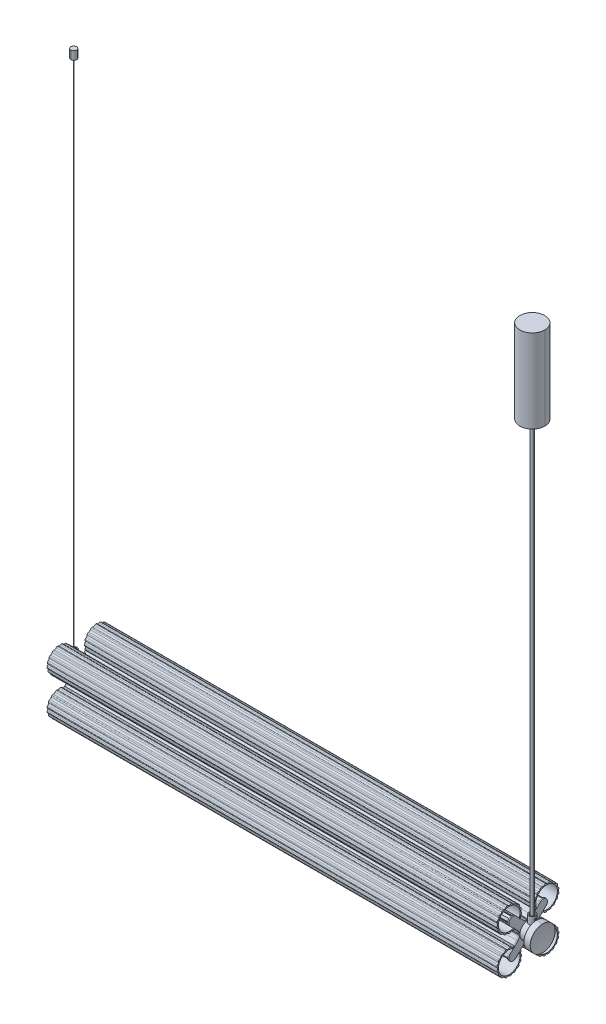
SolidWorks part; units mm, degrees
ref_plane "Alzado" through (0, 0, 0) normal (0, 0, 1) x (1, 0, 0)
ref_plane "Planta" through (0, 0, 0) normal (0, 1, 0) x (1, 0, 0)
ref_plane "Vista lateral" through (0, 0, 0) normal (1, 0, 0) x (0, 0, -1)
imported_body "CRYS_C1359.STEP<1>"
ref_plane "Plano1" through (120, 0, 0) normal (1, 0, 0) x (0, 0, -1)
sketch "Croquis3" plane through (120, 0, 0) normal (1, 0, 0) x (0, 0, -1)
  line L0 (6108.253, 137.8682) -> (6195.2271, 224.8423) construction
  circle A15 centre (6151.74, 181.3552) radius 30.0043 construction
  arc A16 (6107.8994, 151.7982) -> (6122.183, 137.5146) centre (6115.4039, 145.0192) ccw construction
  arc A17 (6195.5806, 210.9123) -> (6181.2971, 225.1959) centre (6188.0761, 217.6913) ccw construction
  circle A21 centre (6196.615, 226.2302) radius 30
  circle A22 centre (6196.615, 226.2302) radius 26
  circle A23 centre (6196.615, 136.4803) radius 30
  circle A24 centre (6196.615, 136.4803) radius 26
  circle A25 centre (6106.8651, 136.4803) radius 30
  circle A26 centre (6106.8651, 136.4803) radius 26
  circle A27 centre (6106.8651, 226.2302) radius 30
  circle A28 centre (6106.8651, 226.2302) radius 26
  point P18 (6184.6205, 235.4489)
  point P19 (6097.6464, 148.4748)
  point P20 (6205.8337, 214.2357)
  point P21 (6118.8596, 127.2616)
  point P29 (6151.74, 181.3552)
  dimension "D1" = 60
  dimension "D2" = 52
  dimension "D3" = 4
extrude "Saliente-Extruir1" add sketch "Croquis3" along normal blind 1080
ref_plane "Plano2" through (160, 0, 0) normal (1, 0, 0) x (0, 0, -1)
sketch "Croquis65" plane through (120, 0, 0) normal (-1, 0, 0) x (0, 0, 1)
  circle A1 centre (-6151.74, 181.3509) radius 30 construction
  circle A37 centre (-6106.8651, 226.2302) radius 32 construction
  circle A56 centre (-6106.8651, 258.2302) radius 4
  circle A75 centre (-6095.3053, 256.0693) radius 4
  circle A94 centre (-6085.3068, 249.8785) radius 4
  circle A95 centre (-6078.2198, 240.4938) radius 4
  circle A96 centre (-6075.0016, 229.1828) radius 4
  circle A97 centre (-6076.0866, 217.473) radius 4
  circle A98 centre (-6081.3285, 206.9459) radius 4
  circle A99 centre (-6090.0192, 199.0233) radius 4
  circle A100 centre (-6100.9851, 194.7751) radius 4
  circle A101 centre (-6112.745, 194.7751) radius 4
  circle A104 centre (-6137.6435, 217.473) radius 4
  circle A105 centre (-6138.7285, 229.1828) radius 4
  circle A106 centre (-6135.5103, 240.4938) radius 4
  circle A107 centre (-6128.4233, 249.8785) radius 4
  circle A108 centre (-6118.4248, 256.0693) radius 4
  circle A109 centre (-6132.4016, 206.9459) radius 4
  circle A110 centre (-6123.7109, 199.0233) radius 4
  circle A111 centre (-6115.6179, 167.2543) radius 4
  circle A112 centre (-6103.9081, 168.3394) radius 4
  circle A113 centre (-6092.5971, 165.1211) radius 4
  circle A114 centre (-6083.2124, 158.0342) radius 4
  circle A115 centre (-6077.0216, 148.0357) radius 4
  circle A116 centre (-6074.8607, 136.4759) radius 4
  circle A117 centre (-6077.0216, 124.9162) radius 4
  circle A118 centre (-6083.2124, 114.9177) radius 4
  circle A119 centre (-6092.5971, 107.8307) radius 4
  circle A120 centre (-6103.9081, 104.6124) radius 4
  circle A121 centre (-6115.6179, 105.6975) radius 4
  circle A122 centre (-6126.145, 110.9394) radius 4
  circle A123 centre (-6134.0677, 119.6301) radius 4
  circle A124 centre (-6138.3159, 130.5959) radius 4
  circle A125 centre (-6138.3159, 142.3559) radius 4
  circle A126 centre (-6165.8366, 145.2288) radius 4
  circle A127 centre (-6164.7515, 133.519) radius 4
  circle A128 centre (-6167.9698, 122.2079) radius 4
  circle A129 centre (-6175.0567, 112.8233) radius 4
  circle A130 centre (-6185.0553, 106.6325) radius 4
  circle A131 centre (-6196.615, 104.4716) radius 4
  circle A132 centre (-6208.1747, 106.6325) radius 4
  circle A133 centre (-6218.1733, 112.8233) radius 4
  circle A134 centre (-6225.2602, 122.2079) radius 4
  circle A135 centre (-6228.4785, 133.519) radius 4
  circle A136 centre (-6227.3934, 145.2288) radius 4
  circle A137 centre (-6222.1516, 155.7559) radius 4
  circle A138 centre (-6213.4608, 163.6785) radius 4
  circle A139 centre (-6202.495, 167.9267) radius 4
  circle A140 centre (-6190.735, 167.9267) radius 4
  circle A141 centre (-6187.8621, 195.4475) radius 4
  circle A142 centre (-6199.5719, 194.3624) radius 4
  circle A143 centre (-6210.883, 197.5806) radius 4
  circle A144 centre (-6220.2676, 204.6676) radius 4
  circle A145 centre (-6226.4585, 214.6661) radius 4
  circle A146 centre (-6228.6193, 226.2259) radius 4
  circle A147 centre (-6226.4585, 237.7856) radius 4
  circle A148 centre (-6220.2676, 247.7841) radius 4
  circle A149 centre (-6210.883, 254.8711) radius 4
  circle A150 centre (-6199.5719, 258.0894) radius 4
  circle A151 centre (-6187.8621, 257.0043) radius 4
  circle A152 centre (-6177.335, 251.7624) radius 4
  circle A153 centre (-6169.4124, 243.0717) radius 4
  circle A154 centre (-6165.1642, 232.1059) radius 4
  circle A155 centre (-6165.1642, 220.3459) radius 4
  point P40 (-6106.8651, 226.2302)
  point P128 (-6151.74, 181.3509)
  dimension "D1" = 64
  dimension "D2" = 8
  dimension "D3" = 17
extrude "Cortar-Extruir2" cut sketch "Croquis65" against normal through all
fillet "Redondeo1" radius 4 30 edges at (660, 217.4538, -6167.9275) (660, 224.0414, -6166.695) (660, 228.4101, -6166.6943) (660, 234.9999, -6167.9254) (660, 239.0727, -6169.5028) (660, 244.7736, -6173.0323) (660, 248.001, -6175.9744) (660, 252.0415, -6181.3253) (660, 253.988, -6185.235) (660, 255.8221, -6191.6834) (660, 256.2246, -6196.0332) (660, 255.6052, -6202.707) (660, 254.4085, -6206.9098) (660, 251.4209, -6212.9069) (660, 196.6388, -6191.6806) (660, 198.4696, -6185.2418) (660, 196.854, -6202.7011) (660, 196.2358, -6196.0378) (660, 201.0349, -6212.8999) (660, 198.0523, -6206.9109) (660, 248.7857, -6216.3951) (660, 243.8354, -6220.9061) (660, 240.1164, -6223.2077) (660, 233.8734, -6225.625) (660, 229.5724, -6226.4283) (660, 222.88, -6226.4273) (660, 218.5778, -6225.6226) (660, 212.339, -6223.2051) (660, 208.6172, -6220.9005) (660, 203.6731, -6216.3932)
fillet "Redondeo2" radius 4 30 edges at (660, 242.5166, -6132.0594) (660, 236.521, -6135.0448) (660, 250.518, -6124.4748) (660, 246.0058, -6129.4244) (660, 255.2393, -6114.5119) (660, 252.8198, -6120.7573) (660, 232.3155, -6136.2414) (660, 225.6464, -6136.8594) (660, 221.2927, -6136.4559) (660, 214.8506, -6134.623) (660, 197.5407, -6115.6349) (660, 196.31, -6109.0512) (660, 196.31, -6104.6789) (660, 197.5407, -6098.0952) (660, 199.1202, -6094.018) (660, 202.6461, -6088.3235) (660, 205.5917, -6085.0923) (660, 210.9366, -6081.056) (660, 214.8506, -6079.1071) (660, 221.2927, -6077.2742) (660, 225.6464, -6076.8707) (660, 232.3155, -6077.4887) (660, 236.521, -6078.6853) (660, 242.5166, -6081.6707) (660, 246.0058, -6084.3057) (660, 250.518, -6089.2553) (660, 256.0427, -6103.5162) (660, 256.0427, -6110.2139) (660, 252.8198, -6092.9728) (660, 255.2393, -6099.2183)
fillet "Redondeo3" radius 4 30 edges at (660, 165.1678, -6187.8387) (660, 166.4008, -6194.4325) (660, 166.4008, -6198.7975) (660, 165.1678, -6205.3913) (660, 163.5904, -6209.4618) (660, 160.059, -6215.1634) (660, 107.4717, -6188.9662) (660, 109.887, -6182.7298) (660, 112.1915, -6179.0065) (660, 116.6976, -6174.0618) (660, 120.1898, -6171.4233) (660, 126.1804, -6168.4385) (660, 130.3875, -6167.2402) (660, 137.0555, -6166.6205) (660, 141.4087, -6167.0226) (660, 147.854, -6168.8546) (660, 157.1164, -6218.39) (660, 151.7655, -6222.429) (660, 147.854, -6224.3754) (660, 141.4087, -6226.2074) (660, 106.6672, -6199.9586) (660, 106.6672, -6193.2714) (660, 109.887, -6210.5002) (660, 107.4717, -6204.2638) (660, 116.6976, -6219.1682) (660, 112.1915, -6214.2235) (660, 126.1804, -6224.7915) (660, 120.1898, -6221.8067) (660, 137.0555, -6226.6095) (660, 130.3875, -6225.9898)
fillet "Redondeo4" radius 4 30 edges at (660, 144.1234, -6077.855) (660, 150.3665, -6080.2723) (660, 154.0855, -6082.574) (660, 159.0357, -6087.085) (660, 161.671, -6090.5731) (660, 164.6586, -6096.5702) (660, 165.8552, -6100.773) (660, 166.4746, -6107.4468) (660, 166.0721, -6111.7966) (660, 164.238, -6118.2451) (660, 133.13, -6077.0527) (660, 139.8224, -6077.0518) (660, 122.589, -6080.275) (660, 128.8279, -6077.8574) (660, 113.9232, -6087.0868) (660, 118.8673, -6082.5796) (660, 108.3023, -6096.5692) (660, 111.285, -6090.5802) (660, 106.4858, -6107.4423) (660, 107.1041, -6100.779) (660, 108.7197, -6118.2383) (660, 106.8888, -6111.7995) (660, 114.7032, -6127.499) (660, 110.6686, -6122.1542) (660, 123.629, -6133.9731) (660, 117.9337, -6130.4452) (660, 134.2914, -6136.7851) (660, 127.7038, -6135.5526) (660, 145.25, -6135.5546) (660, 138.6601, -6136.7857)
